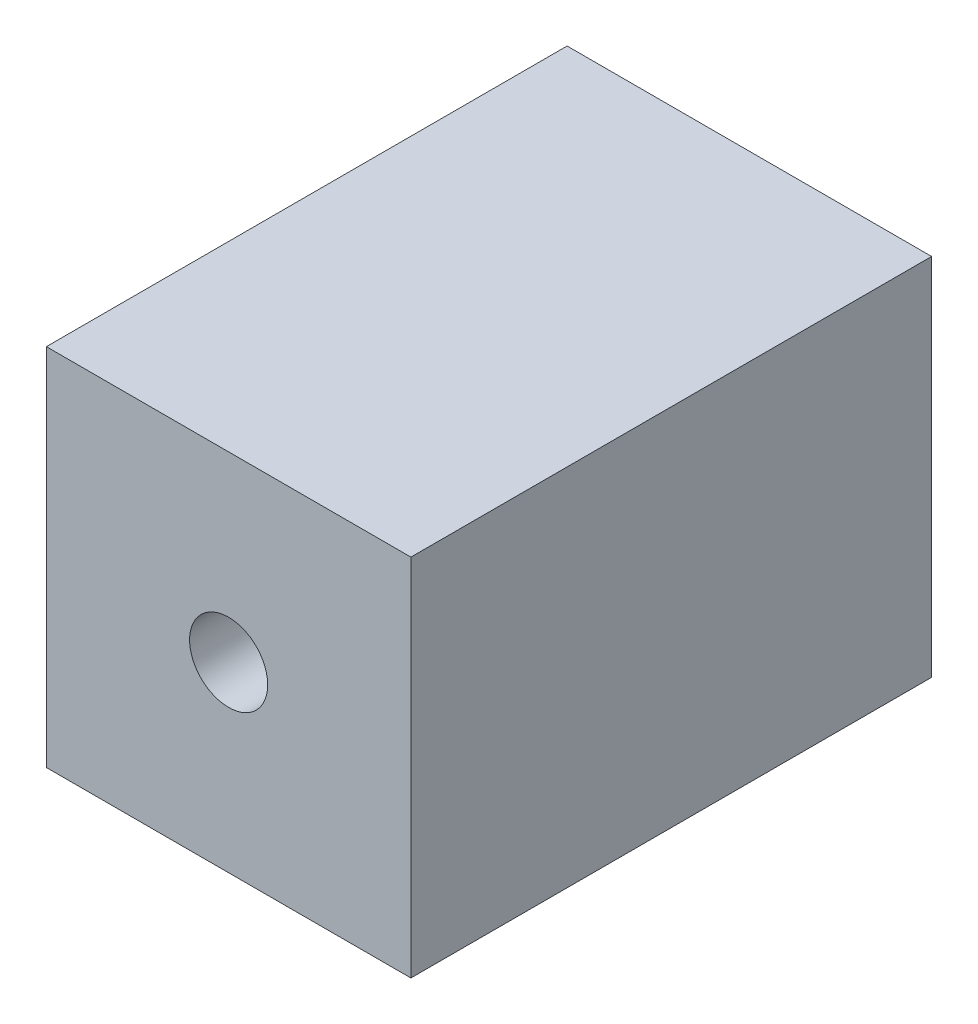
SolidWorks part; units mm, degrees
ref_plane "前视基准面" through (0, 0, 0) normal (0, 0, 1) x (1, 0, 0)
ref_plane "上视基准面" through (0, 0, 0) normal (0, 1, 0) x (1, 0, 0)
ref_plane "右视基准面" through (0, 0, 0) normal (1, 0, 0) x (0, 0, -1)
sketch "草图1" plane through (0, 0, 0) normal (0, 0, 1) x (1, 0, 0)
  line L1 (-14, -14) -> (14, -14)
  line L2 (-14, -14) -> (-14, 14)
  line L3 (-14, 14) -> (14, 14)
  line L4 (14, -14) -> (14, 14)
  line L5 (-14, -14) -> (14, 14) construction
  line L6 (-14, 14) -> (14, -14) construction
  circle A0 centre (0, 0) radius 3
  point P0 (0, 0)
  dimension "D3" = 6
  dimension "D1" = 28
  dimension "D2" = 28
extrude "凸台-拉伸1" add sketch "草图1" along normal blind 40
